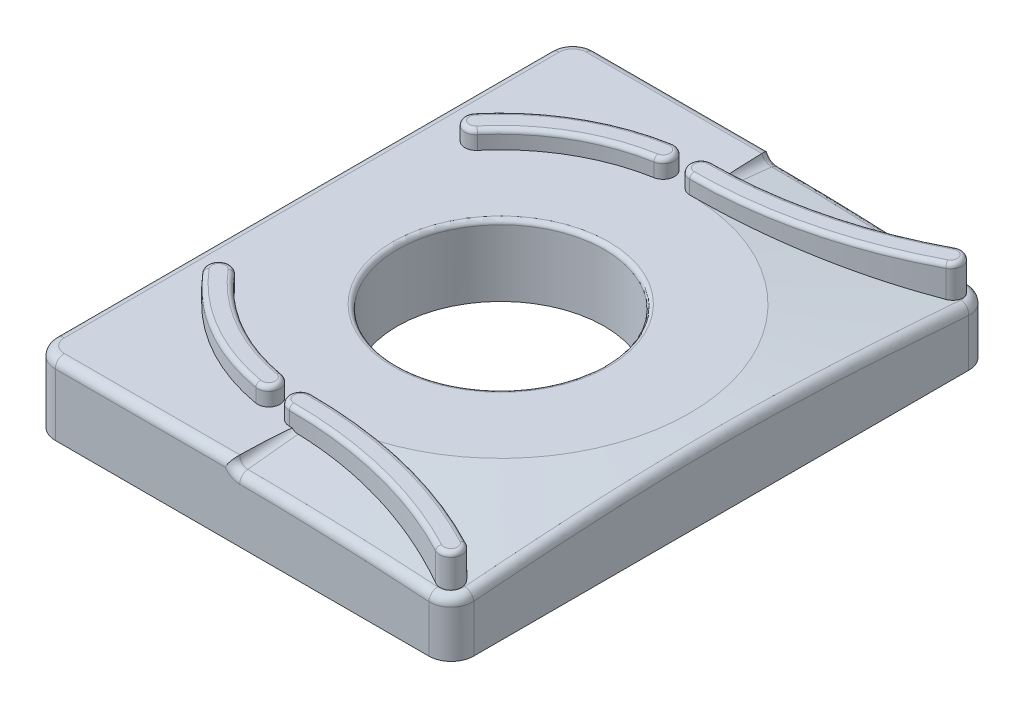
SolidWorks part; units mm, degrees
ref_plane "Front" through (0, 0, 0) normal (0, 0, 1) x (1, 0, 0)
ref_plane "Top" through (0, 0, 0) normal (0, 1, 0) x (1, 0, 0)
ref_plane "Right" through (0, 0, 0) normal (1, 0, 0) x (0, 0, -1)
sketch "Sketch2" plane through (0, 0, 0) normal (0, 1, 0) x (1, 0, 0)
  line L1 (-27.94, -38.1) -> (31.115, -38.1)
  line L2 (-27.94, -38.1) -> (-27.94, 38.1)
  line L3 (-27.94, 38.1) -> (31.115, 38.1)
  line L4 (31.115, -38.1) -> (31.115, 38.1)
  circle A0 centre (0, 0) radius 14.605
  point P0 (0, 0)
  point P8 (31.115, 0)
  dimension "D1" = 29.21
  dimension "D2" = 27.94
  dimension "D3" = 76.2
  dimension "1.225" = 31.115
extrude "Boss-Extrude1" add sketch "Sketch2" along normal blind 10
sketch "Sketch3" plane through (0, 0, 0) normal (0, 0, 1) x (1, 0, 0)
  line L0 (0, 0) -> (0, 19.05) construction
  line L2 (-27.94, 10) -> (31.115, 10) construction
  line L3 (26.67, 10) -> (26.67, 24.4507)
  line L4 (26.67, 24.4507) -> (50.8, 24.4507)
  line L5 (50.8, 24.4507) -> (50.8, 7.4638)
  line L6 (0, 10) -> (0, 0) construction
  line L7 (50.8, 7.4638) -> (26.67, 10)
  dimension "D1" = 6
  dimension "D2" = 53.34
  dimension "D3" = 101.6
revolve "Cut-Revolve3" cut sketch "Sketch3" angle 180 mid plane about L0
fillet "Fillet1" radius 3.175 4 edges at (-27.94, 5, -38.1) (31.115, 3.8165, -38.1) (31.115, 3.8165, 38.1) (-27.94, 5, 38.1)
fillet "Fillet5" radius 1.27 2 edges at (0, 9.3993, -32.385) (0, 9.3993, 32.385)
fillet "Fillet2" radius 1.27 12 edges at (-12.3814, 10, -38.1) (-27.0101, 10, -37.1701) (-12.3814, 10, 38.1) (-27.0101, 10, 37.1701) (-27.94, 10, 0) (0.3282, 9.2167, -38.1) (30.4208, 7.7762, -36.9065) (29.9184, 7.7686, 37.4082) (0.4764, 9.0764, 38.1)
fillet "Fillet6" radius 0.635 1 edges at (0, 10, 14.605)
sketch "Sketch9" plane through (0, 0, 0) normal (0, -1, 0) x (1, 0, 0)
  line L28 (-26.035, 34.925) -> (-26.035, -34.925)
  line L29 (-24.765, -36.195) -> (27.94, -36.195)
  line L30 (29.21, -34.925) -> (29.21, 34.925)
  line L31 (27.94, 36.195) -> (-24.765, 36.195)
  line L32 (-26.035, 34.925) -> (-26.035, -34.925)
  line L33 (-24.765, -36.195) -> (27.94, -36.195)
  line L34 (29.21, -34.925) -> (29.21, 34.925)
  line L35 (27.94, 36.195) -> (-24.765, 36.195)
  circle A31 centre (0, 0) radius 17.78
  circle A32 centre (0, 0) radius 17.78
  arc A33 (-26.035, -34.925) -> (-24.765, -36.195) centre (-24.765, -34.925) ccw
  arc A34 (27.94, -36.195) -> (29.21, -34.925) centre (27.94, -34.925) ccw
  arc A35 (29.21, 34.925) -> (27.94, 36.195) centre (27.94, 34.925) ccw
  arc A36 (-24.765, 36.195) -> (-26.035, 34.925) centre (-24.765, 34.925) ccw
  arc A37 (-26.035, -34.925) -> (-24.765, -36.195) centre (-24.765, -34.925) ccw
  arc A38 (27.94, -36.195) -> (29.21, -34.925) centre (27.94, -34.925) ccw
  arc A39 (29.21, 34.925) -> (27.94, 36.195) centre (27.94, 34.925) ccw
  arc A40 (-24.765, 36.195) -> (-26.035, 34.925) centre (-24.765, 34.925) ccw
  dimension "D1" = 1.905
  dimension "D2" = 3.175
extrude "Cut-Extrude1" cut sketch "Sketch9" against normal offset from surface (4.92 mm away) 5.08
sketch "Sketch11" plane through (0, 4.92, 0) normal (0, -1, 0) x (1, 0, 0)
  circle A0 centre (0, 0) radius 17.78
  circle A1 centre (0, 0) radius 25
  circle A2 centre (0, 0) radius 14.605 construction
  dimension "D1" = 50
  dimension "D2" = 35.56
extrude "RFID Cutout" cut sketch "Sketch11" against normal offset from surface (2.54 mm away) 2.54
sketch "Sketch10" plane through (0, 4.92, 0) normal (0, -1, 0) x (1, 0, 0)
  line L3 (19.05, 25.4) -> (-19.05, 25.4) construction
  line L4 (19.05, 25.4) -> (19.05, -25.4) construction
  line L5 (19.05, -25.4) -> (-19.05, -25.4) construction
  line L6 (-19.05, 25.4) -> (-19.05, -25.4) construction
  circle A1 centre (-19.05, 25.4) radius 4.7625
  circle A3 centre (19.05, 25.4) radius 4.7625
  circle A5 centre (19.05, -25.4) radius 4.7625
  circle A7 centre (-19.05, -25.4) radius 4.7625
  point P3 (0, 25.4)
  point P10 (19.05, 0)
  dimension "D2" = 9.525
  dimension "D3" = 38.1
  dimension "D4" = 2
  dimension "D6" = 50.8
  dimension "D5" = 2
extrude "Boss-Extrude3" add sketch "Sketch10" along normal up to surface (4.92 mm away)
sketch "Sketch12" plane through (0, 0, 0) normal (0, -1, 0) x (1, 0, 0)
  circle A0 centre (-19.05, 25.4) radius 3.6
  circle A1 centre (19.05, 25.4) radius 3.6
  circle A2 centre (19.05, -25.4) radius 3.6
  circle A3 centre (-19.05, -25.4) radius 3.6
  dimension "D1" = 7.2
extrude "Cut-Extrude3" cut sketch "Sketch12" against normal blind 0.85
hole_wizard "#2 (0.221) Diameter Hole1" positions "Sketch15" profile "Sketch17" hole size "#2" standard "ANSI Inch"
sketch "Sketch15" plane through (0, 0.85, 0) normal (0, -1, 0) x (-1, 0, 0)
  point P0 (-19.05, -25.4)
  point P3 (19.05, -25.4)
  point P5 (19.05, 25.4)
  point P8 (-19.05, 25.4)
sketch "Sketch17" plane through (19.05, 0.85, 25.4) normal (1, 0, 0) x (0, 0, -1)
  line L0 (0, 0) -> (0, 6.4364)
  line L1 (0, 6.4364) -> (2.8067, 4.75)
  line L2 (2.8067, 4.75) -> (2.8067, 0)
  line L5 (2.8067, 0) -> (0, 0)
  line L10 (0, 6.4364) -> (-2.8067, 4.75) construction
  line L11 (0, -6.35) -> (0, 107.95) construction
  dimension "Hole Dia." = 5.6134
  dimension "Hole Depth" = 4.75
  dimension "Drill Angle" = 118
sketch "Sketch7" plane through (0, 10, 0) normal (0, 1, 0) x (1, 0, 0)
  line L0 (-4.9069, 27.8282) -> (0, 0) construction
  line L1 (0, 0) -> (-21.6465, 18.1636) construction
  line L2 (0, 0) -> (-14.1287, 24.4717) construction
  line L3 (0, 0) -> (-27.94, 0) construction
  line L4 (-27.94, 34.925) -> (-27.94, -34.925) construction
  circle A0 centre (0, 0) radius 26.67 construction
  arc A1 (-4.9069, 27.8282) -> (-21.6465, 18.1636) centre (0, 0) ccw construction
  arc A2 (-4.6312, 26.2648) -> (-5.1825, 29.3916) centre (-4.9069, 27.8282) ccw
  arc A3 (-22.8626, 19.184) -> (-20.4304, 17.1431) centre (-21.6465, 18.1636) ccw
  arc A4 (-5.1825, 29.3916) -> (-22.8626, 19.184) centre (0, 0) ccw
  arc A5 (-20.4304, 17.1431) -> (-4.6312, 26.2648) centre (0, 0) cw
  arc A6 (0, 28.2575) -> (28.2231, 35.2646) centre (0, 88.5996) ccw construction
  arc A7 (0, 26.67) -> (28.9656, 33.8614) centre (0, 88.5996) ccw
  arc A8 (0, 29.845) -> (27.4806, 36.6677) centre (0, 88.5996) ccw
  arc A9 (0, 29.845) -> (0, 26.67) centre (0, 28.2575) ccw
  arc A10 (28.9656, 33.8614) -> (27.4806, 36.6677) centre (28.2231, 35.2646) ccw
  point P18 (14.5399, 30.0355)
  dimension "D1" = 53.34
  dimension "D4" = 1.5875
  dimension "D2" = 40
  dimension "D3" = 60
extrude "Boss-Extrude2" add sketch "Sketch7" along normal blind 2.54 and the other way up to surface
mirror "Mirror1" about plane through (0, 0, 0) normal (0, 0, 1) of "Boss-Extrude2"
fillet "Fillet7" radius 0.635 16 edges at (-22.6669, 12.54, 16.9475) (-13.335, 12.54, 23.0969) (-3.3435, 12.54, 28.1039) (-14.9225, 12.54, 25.8465) (-3.3435, 12.54, -28.1039) (-13.335, 12.54, -23.0969) (-22.6669, 12.54, -16.9475) (-14.9225, 12.54, -25.8465) (14.1574, 12.54, -31.5762) (29.6262, 12.54, -36.0071) (14.9225, 12.54, -28.4947) (-1.5875, 12.54, -28.2575) (14.9225, 12.54, 28.4947) (29.6262, 12.54, 36.0071) (14.1574, 12.54, 31.5762) (-1.5875, 12.54, 28.2575)
sketch "Sketch18" plane through (-27.94, 0, 0) normal (-1, 0, 0) x (0, 0, 1)
  line L0 (-34.925, 0) -> (34.925, 0) construction
  line L8 (-35, 0) -> (35, 0)
  line L9 (-35, 0) -> (-35, 3)
  line L10 (-34, 4) -> (34, 4)
  line L11 (35, 0) -> (35, 3)
  arc A2 (34, 4) -> (35, 3) centre (34, 3) cw
  arc A3 (-35, 3) -> (-34, 4) centre (-34, 3) cw
  point P6 (0, 0)
  point P11 (-35, 4)
  dimension "D1" = 70
  dimension "D3" = 1
  dimension "D2" = 4
extrude "Cut-Extrude4" cut sketch "Sketch18" against normal blind 3
fillet "Fillet8" radius 1 2 edges at (-26.9859, 0, 35) (-26.9859, 0, -35)
